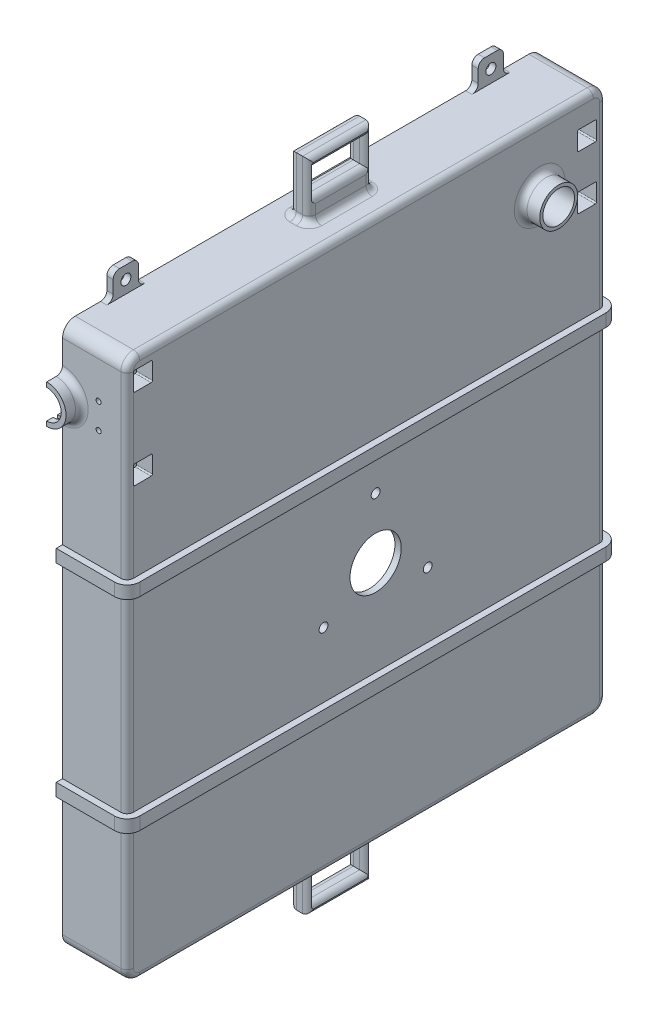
SolidWorks part; units mm, degrees
ref_plane "Front Plane" through (0, 0, 0) normal (0, 0, 1) x (1, 0, 0)
ref_plane "Top Plane" through (0, 0, 0) normal (0, 1, 0) x (1, 0, 0)
ref_plane "Right Plane" through (0, 0, 0) normal (1, 0, 0) x (0, 0, -1)
sketch "Sketch2" plane through (0, 0, 0) normal (1, 0, 0) x (0, 0, -1)
  line L0 (-382.5, 462.7139) -> (-382.5, -373.2861)
  line L1 (354, -373.2861) -> (-382.5, -373.2861)
  line L3 (-382.5, 462.7139) -> (354, 462.7139)
  line L4 (354, -373.2861) -> (354, 462.7139)
  line L9 (354, 350.7139) -> (354, 398.7139) construction
  line L11 (354, 374.7139) -> (-385.5, 374.7139) construction
  dimension "D1" = 88
  dimension "D2" = 736.5
  dimension "D3" = 3
  dimension "D4" = 836
extrude "Boss-Extrude1" add sketch "Sketch2" along normal blind 92
shell "Shell1" thickness 10
sketch "Sketch3" plane through (0, 0, 392.5) normal (0, 0, 1) x (1, 0, 0)
  circle A0 centre (0, 374.7139) radius 23
  dimension "D1" = 46
extrude "Cut-Extrude1" cut sketch "Sketch3" against normal blind 92
sketch "Sketch5" plane through (0, 0, 392.5) normal (0, 0, 1) x (1, 0, 0)
  line L0 (0, 405.2139) -> (0, 397.7139)
  line L3 (0, 351.7139) -> (0, 344.2139)
  arc A0 (0, 351.7139) -> (0, 397.7139) centre (0, 374.7139) ccw
  arc A1 (0, 344.2139) -> (0, 405.2139) centre (0, 374.7139) ccw
  dimension "D1" = 46
  dimension "D2" = 61
extrude "Boss-Extrude2" add sketch "Sketch5" along normal blind 25 contours A1 L0 A0 L3
sketch "Sketch6" plane through (0, 0, 0) normal (-1, 0, 0) x (0, 0, 1)
  line L0 (400.5, 351.7139) -> (407.5, 351.7139)
  line L1 (417.5, 351.7139) -> (382.5, 351.7139) construction
  line L2 (407.5, 351.7139) -> (407.5, 347.2139)
  line L3 (407.5, 347.2139) -> (400.5, 347.2139)
  line L4 (400.5, 347.2139) -> (400.5, 351.7139)
  line L5 (417.5, 351.7139) -> (417.5, 344.2139) construction
  line L6 (462.1748, 374.7139) -> (490.4215, 374.7139) construction
  line L7 (417.5, 374.7139) -> (392.5, 374.7139) construction
  dimension "D1" = 4.5
  dimension "D2" = 10
  dimension "D3" = 7
revolve "Cut-Revolve1" cut sketch "Sketch6" angle 360 about L6
fillet "Fillet1" radius 10 1 edges at (30.5, 374.7139, 392.5)
fillet "Fillet2" radius 20 7 edges at (46, -373.2861, 382.5) (46, -373.2861, -354) (51, -383.2861, 392.5) (51, -383.2861, -364) (46, 462.7139, -354) (51, 472.7139, -364) (51, 472.7139, 392.5)
sketch "Sketch10" plane through (0, 0, -354) normal (0, 0, 1) x (1, 0, 0)
  line L0 (0, 374.7139) -> (105.7299, 374.7139) construction
  circle A0 centre (45, 394.7139) radius 4
  circle A1 centre (45, 354.7139) radius 4
  dimension "D1" = 8
  dimension "D2" = 20
  dimension "D3" = 45
extrude "Cut-Extrude5" cut sketch "Sketch10" against normal blind 10
sketch "Sketch11" plane through (0, 472.7139, 0) normal (0, 1, 0) x (1, 0, 0)
  line L0 (0, 344) -> (0, -372.5) construction
  line L1 (0, 294) -> (10, 294)
  line L2 (0, 294) -> (0, 254)
  line L3 (0, 254) -> (10, 254)
  line L4 (10, 294) -> (10, 254)
  line L5 (102, 344) -> (0, 344) construction
  line L6 (0, -355.5) -> (0, -91.5) construction
  line L7 (0, -322.5) -> (10, -322.5)
  line L8 (0, -322.5) -> (0, -282.5)
  line L9 (0, -282.5) -> (10, -282.5)
  line L10 (10, -322.5) -> (10, -282.5)
  line L11 (0, -372.5) -> (102, -372.5) construction
  dimension "D1" = 10
  dimension "D2" = 40
  dimension "D3" = 50
  dimension "D4" = 40
  dimension "D5" = 10
  dimension "D6" = 50
extrude "Boss-Extrude4" add sketch "Sketch11" along normal blind 40
fillet "Fillet4" radius 10 8 edges at (5, 512.7139, -254) (5, 472.7139, -254) (5, 512.7139, -294) (5, 472.7139, -294) (5, 512.7139, 282.5) (5, 472.7139, 282.5) (5, 472.7139, 322.5) (5, 512.7139, 322.5)
sketch "Sketch12" plane through (0, 0, 0) normal (-1, 0, 0) x (0, 0, 1)
  line L0 (292.5, 512.7139) -> (312.5, 512.7139) construction
  line L1 (-254, 502.7139) -> (-254, 482.7139) construction
  line L2 (322.5, 502.7139) -> (322.5, 482.7139) construction
  line L3 (-284, 512.7139) -> (-264, 512.7139) construction
  circle A0 centre (302.5, 492.7139) radius 8
  circle A1 centre (-274, 492.7139) radius 8
  dimension "D1" = 16
  dimension "D2" = 16
  dimension "D3" = 20
  dimension "D4" = 20
  dimension "D5" = 20
  dimension "D6" = 20
extrude "Cut-Extrude6" cut sketch "Sketch12" against normal blind 40
sketch "Sketch13" plane through (0, 0, 0) normal (-1, 0, 0) x (0, 0, 1)
  line L0 (74.0966, 472.7139) -> (74.0966, -383.2861) construction
  line L1 (-244, 472.7139) -> (272.5, 472.7139) construction
  line L2 (372.5, -383.2861) -> (-344, -383.2861) construction
  line L3 (74.0966, 44.7139) -> (483.6536, 44.7139) construction
ref_plane "Plane1" through (0, 44.7139, 0) normal (0, 1, 0) x (1, 0, 0)
mirror "Mirror1" about plane through (0, 44.7139, 0) normal (0, 1, 0) of "Boss-Extrude4", "Fillet4", "Cut-Extrude6"
fillet "Fillet5" radius 10 4 edges at (5, -383.2861, 282.5) (5, -383.2861, 322.5) (5, -383.2861, -254) (5, -383.2861, -294)
sketch "Sketch14" plane through (0, 0, 0) normal (-1, 0, 0) x (0, 0, 1)
  line L0 (-334, 462.7139) -> (382.5, 462.7139) construction
  line L1 (-304, 462.7139) -> (-244, 462.7139)
  line L2 (332.5, 462.7139) -> (272.5, 462.7139)
  line L3 (74.0966, 44.7139) -> (483.6536, 44.7139) construction
  line L4 (332.5, -373.2861) -> (272.5, -373.2861)
  line L5 (-304, -373.2861) -> (-244, -373.2861)
  line L6 (362.5, -373.2861) -> (-334, -373.2861) construction
  line L7 (-354, -353.2861) -> (-354, 442.7139) construction
  line L8 (332.5, -373.2861) -> (272.5, -373.2861)
  line L9 (-354, -353.2861) -> (-354, -348.2861)
  line L10 (-329, -373.2861) -> (-334, -373.2861)
  line L11 (-244, -373.2861) -> (-304, -373.2861)
  line L12 (-329, 462.7139) -> (-334, 462.7139)
  line L13 (-354, 442.7139) -> (-354, 437.7139)
  line L14 (-364, 44.7139) -> (392.5, 44.7139) construction
  line L15 (-364, -363.2861) -> (-364, 452.7139) construction
  line L16 (392.5, 334.2139) -> (392.5, -363.2861) construction
  line L17 (14.25, 44.7139) -> (14.25, 144.8214) construction
  line L18 (357.5, -373.2861) -> (362.5, -373.2861)
  line L19 (382.5, -353.2861) -> (382.5, -348.2861)
  line L20 (382.5, 442.7139) -> (382.5, 437.7139)
  line L21 (357.5, 462.7139) -> (362.5, 462.7139)
  arc A0 (-304, 462.7139) -> (-244, 462.7139) centre (-274, 462.7139) ccw
  arc A1 (272.5, 462.7139) -> (332.5, 462.7139) centre (302.5, 462.7139) ccw
  arc A2 (392.5, 452.7139) -> (372.5, 472.7139) centre (372.5, 452.7139) ccw construction
  arc A3 (-304, -373.2861) -> (-244, -373.2861) centre (-274, -373.2861) cw
  arc A4 (272.5, -373.2861) -> (332.5, -373.2861) centre (302.5, -373.2861) cw
  arc A5 (-329, -373.2861) -> (-354, -348.2861) centre (-354, -373.2861) ccw
  arc A6 (-354, -353.2861) -> (-334, -373.2861) centre (-334, -353.2861) ccw construction
  arc A7 (-354, -353.2861) -> (-334, -373.2861) centre (-334, -353.2861) ccw
  arc A8 (-354, 442.7139) -> (-334, 462.7139) centre (-334, 442.7139) cw
  arc A9 (-329, 462.7139) -> (-354, 437.7139) centre (-354, 462.7139) cw
  arc A10 (382.5, -353.2861) -> (362.5, -373.2861) centre (362.5, -353.2861) cw
  arc A11 (357.5, -373.2861) -> (382.5, -348.2861) centre (382.5, -373.2861) cw
  dimension "D1" = 60
  dimension "D3" = 60
  dimension "D4" = 70
  dimension "D5" = 50
  dimension "D2" = 70
extrude "Boss-Extrude5" add sketch "Sketch14" against normal through all
fillet "Fillet6" radius 10 15 edges at (92, 445.0363, -336.3223) (92, 462.7139, -316.5) (92, 432.7139, -274) (92, 462.7139, 14.25) (92, 432.7139, 302.5) (92, 462.7139, 357.5) (92, 57.2139, 382.5) (92, -355.6084, 364.8223) (92, -373.2861, 345) (92, -343.2861, 302.5) (92, -373.2861, 14.25) (92, -343.2861, -274) (92, -373.2861, -316.5) (92, -355.6084, -336.3223) (92, 44.7139, -354)
fillet "Fillet7" radius 10 8 edges at (102, 466.8561, 386.6421) (102, 472.7139, 14.25) (102, 466.8561, -358.1421) (102, 44.7139, -364) (102, -377.4282, -358.1421) (102, -383.2861, 14.25) (102, -377.4282, 386.6421) (102, 44.7139, 392.5)
sketch "Sketch15" plane through (102, 0, 0) normal (1, 0, 0) x (0, 0, -1)
  circle A0 centre (0, 0) radius 40.5
  dimension "D1" = 81
extrude "Cut-Extrude7" cut sketch "Sketch15" against normal blind 40
sketch "Sketch16" plane through (102, 0, 0) normal (1, 0, 0) x (0, 0, -1)
  circle A0 centre (0, 0) radius 28
  circle A1 centre (0, 0) radius 33
  dimension "D1" = 56
  dimension "D2" = 66
ref_plane "Plane2" through (0, 150, 0) normal (0, 1, 0) x (1, 0, 0)
sketch "Sketch19" plane through (0, 150, 0) normal (0, 1, 0) x (1, 0, 0)
  line L0 (0, -402.5) -> (92, -402.5)
  line L1 (0, 364) -> (92, 364)
  line L3 (0, -392.5) -> (92, -392.5)
  line L4 (102, 354) -> (102, -382.5)
  line L5 (112, 354) -> (112, -382.5)
  line L6 (0, 374) -> (92, 374)
  line L7 (0, -402.5) -> (0, -392.5)
  line L8 (0, 374) -> (0, 364)
  arc A0 (92, 364) -> (102, 354) centre (92, 354) cw
  arc A1 (92, -392.5) -> (102, -382.5) centre (92, -382.5) ccw
  arc A2 (92, -402.5) -> (112, -382.5) centre (92, -382.5) ccw
  arc A3 (92, 374) -> (112, 354) centre (92, 354) cw
  point P7 (102, 364)
  point P10 (102, -392.5)
  dimension "D3" = 10
  dimension "D1" = 92
  dimension "D2" = 756.5
  dimension "D4" = 10
extrude "Boss-Extrude7" add sketch "Sketch19" along normal blind 20
sketch "Sketch21" plane through (0, 0, -354) normal (0, 0, 1) x (1, 0, 0)
  line L0 (0, 472.7139) -> (0, -383.2861) construction
  line L1 (10, 430.7139) -> (0, 430.7139)
  line L2 (10, 430.7139) -> (10, 410.7139)
  line L3 (10, 410.7139) -> (0, 410.7139)
  line L4 (0, 430.7139) -> (0, 410.7139)
  dimension "D1" = 20
sketch "Sketch25" plane through (92, 0, 0) normal (-1, 0, 0) x (0, 0, 1)
  line L0 (-316, 462.7139) -> (-316, 332.7139)
  line L1 (-354, -348.2861) -> (-354, 437.7139) construction
  line L2 (-316, 462.7139) -> (-354, 462.7139)
  line L3 (-354, 462.7139) -> (-354, 282.7139)
  line L4 (-329, 462.7139) -> (-304, 462.7139) construction
  arc A0 (-316, 332.7139) -> (-354, 282.7139) centre (-367.8947, 332.7139) cw
  dimension "D1" = 130
  dimension "D2" = 50
  dimension "D3" = 38
extrude "Boss-Extrude8" add sketch "Sketch25" along normal blind 32
fillet "Fillet10" radius 2 11 edges at (60, 360.2139, -354) (60, 462.7139, -322.5) (71, 282.7139, -354) (87.4318, 283.1876, -352.3962) (71, 462.7139, -316) (89.0711, 459.785, -316) (92, 392.7139, -316) (60, 397.7139, -316) (92, 305.7598, -323.5491) (60, 301.3133, -326.5781) (60, 445.0363, -336.3223)
sketch "Sketch26" plane through (60, 0, 0) normal (-1, 0, 0) x (0, 0, 1)
  circle A0 centre (-334, 417.2139) radius 7
  circle A1 centre (-334, 332.2139) radius 7
  dimension "D1" = 14
  dimension "D2" = 14
extrude "Cut-Extrude10" cut sketch "Sketch26" against normal through all
sketch "Sketch27" plane through (102, 0, 0) normal (1, 0, 0) x (0, 0, -1)
  line L1 (321, 402.2139) -> (347, 402.2139)
  line L2 (319, 404.2139) -> (319, 430.2139)
  line L3 (321, 432.2139) -> (347, 432.2139)
  line L4 (349, 404.2139) -> (349, 430.2139)
  line L5 (319, 402.2139) -> (349, 432.2139) construction
  line L6 (319, 432.2139) -> (349, 402.2139) construction
  line L7 (321, 317.2139) -> (347, 317.2139)
  line L8 (319, 319.2139) -> (319, 345.2139)
  line L9 (321, 347.2139) -> (347, 347.2139)
  line L10 (349, 319.2139) -> (349, 345.2139)
  line L11 (319, 317.2139) -> (349, 347.2139) construction
  line L12 (319, 347.2139) -> (349, 317.2139) construction
  arc A0 (347, 317.2139) -> (349, 319.2139) centre (347, 319.2139) ccw
  arc A1 (321, 317.2139) -> (319, 319.2139) centre (321, 319.2139) cw
  arc A2 (347, 347.2139) -> (349, 345.2139) centre (347, 345.2139) cw
  arc A3 (319, 345.2139) -> (321, 347.2139) centre (321, 345.2139) cw
  arc A4 (347, 432.2139) -> (349, 430.2139) centre (347, 430.2139) cw
  arc A5 (347, 402.2139) -> (349, 404.2139) centre (347, 404.2139) ccw
  arc A6 (321, 402.2139) -> (319, 404.2139) centre (321, 404.2139) cw
  arc A7 (319, 430.2139) -> (321, 432.2139) centre (321, 430.2139) cw
  point P0 (334, 417.2139)
  point P6 (334, 332.2139)
  dimension "D2" = 2
  dimension "D1" = 30
extrude "Cut-Extrude11" cut sketch "Sketch27" against normal blind 35
sketch "Sketch28" plane through (92, 0, 0) normal (-1, 0, 0) x (0, 0, 1)
  line L0 (344.5, 462.7139) -> (344.5, 312.7139)
  line L1 (332.5, 462.7139) -> (382.5, 462.7139) construction
  line L3 (382.5, 351.7139) -> (382.5, -348.2861) construction
  line L4 (344.5, 462.7139) -> (382.5, 462.7139)
  line L5 (382.5, 462.7139) -> (382.5, 266.7139)
  arc A0 (382.5, 266.7139) -> (344.5, 312.7139) centre (391.3421, 312.7139) cw
  dimension "D1" = 38
  dimension "D2" = 150
  dimension "D3" = 46
extrude "Boss-Extrude10" add sketch "Sketch28" along normal blind 30
fillet "Fillet11" radius 2 10 edges at (89.0711, 459.785, 344.5) (62, 364.7139, 382.5) (72, 462.7139, 344.5) (62, 282.8811, 355.2286) (92, 382.7139, 344.5) (72, 266.7139, 382.5) (89.6848, 267.5548, 378.8988) (62, 462.7139, 363.5) (62, 387.7139, 344.5) (92, 287.1056, 352.1197)
sketch "Sketch29" plane through (102, 0, 0) normal (1, 0, 0) x (0, 0, -1)
  circle A0 centre (-367.5, 438.7139) radius 7
  circle A1 centre (-367.5, 310.7139) radius 7
  dimension "D1" = 14
  dimension "D2" = 14
extrude "Cut-Extrude12" cut sketch "Sketch29" against normal through all
sketch "Sketch30" plane through (102, 0, 0) normal (1, 0, 0) x (0, 0, -1)
  line L1 (-380.5, 423.7139) -> (-354.5, 423.7139)
  line L2 (-382.5, 425.7139) -> (-382.5, 451.7139)
  line L3 (-380.5, 453.7139) -> (-354.5, 453.7139)
  line L4 (-352.5, 425.7139) -> (-352.5, 451.7139)
  line L5 (-382.5, 423.7139) -> (-352.5, 453.7139) construction
  line L6 (-382.5, 453.7139) -> (-352.5, 423.7139) construction
  line L7 (-380.5, 325.7139) -> (-354.5, 325.7139)
  line L8 (-382.5, 323.7139) -> (-382.5, 297.7139)
  line L9 (-380.5, 295.7139) -> (-354.5, 295.7139)
  line L10 (-352.5, 323.7139) -> (-352.5, 297.7139)
  line L11 (-382.5, 325.7139) -> (-352.5, 295.7139) construction
  line L12 (-382.5, 295.7139) -> (-352.5, 325.7139) construction
  arc A0 (-380.5, 325.7139) -> (-382.5, 323.7139) centre (-380.5, 323.7139) ccw
  arc A1 (-382.5, 297.7139) -> (-380.5, 295.7139) centre (-380.5, 297.7139) ccw
  arc A2 (-354.5, 295.7139) -> (-352.5, 297.7139) centre (-354.5, 297.7139) ccw
  arc A3 (-352.5, 323.7139) -> (-354.5, 325.7139) centre (-354.5, 323.7139) ccw
  arc A4 (-354.5, 453.7139) -> (-352.5, 451.7139) centre (-354.5, 451.7139) cw
  arc A5 (-354.5, 423.7139) -> (-352.5, 425.7139) centre (-354.5, 425.7139) ccw
  arc A6 (-382.5, 425.7139) -> (-380.5, 423.7139) centre (-380.5, 425.7139) ccw
  arc A7 (-382.5, 451.7139) -> (-380.5, 453.7139) centre (-380.5, 451.7139) cw
  point P0 (-367.5, 438.7139)
  point P6 (-367.5, 310.7139)
  dimension "D2" = 2
  dimension "D1" = 30
extrude "Cut-Extrude13" cut sketch "Sketch30" against normal blind 25
sketch "Sketch31" plane through (0, 0, 392.5) normal (0, 0, 1) x (1, 0, 0)
  circle A0 centre (57, 394.7139) radius 4
  circle A1 centre (57, 354.7139) radius 4
  dimension "D1" = 8
  dimension "D2" = 8
extrude "Cut-Extrude14" cut sketch "Sketch31" against normal blind 26
sketch "Sketch32" plane through (102, 0, 0) normal (1, 0, 0) x (0, 0, -1)
  circle A0 centre (0, 95) radius 7
  circle A1 centre (-82.2724, -47.5) radius 7
  circle A2 centre (82.2724, -47.5) radius 7
  dimension "D1" = 14
  dimension "D2" = 14
  dimension "D3" = 14
extrude "Cut-Extrude15" cut sketch "Sketch32" against normal through all
mirror "Mirror2" about plane through (0, 0, 0) normal (0, 1, 0) of "Boss-Extrude7"
sketch "Sketch33" plane through (0, 472.7139, 0) normal (0, 1, 0) x (1, 0, 0)
  line L0 (46, -372.5) -> (46, 344) construction
  line L1 (31, -64.25) -> (61, -64.25)
  line L2 (31, -64.25) -> (31, 35.75)
  line L3 (31, 35.75) -> (61, 35.75)
  line L4 (61, -64.25) -> (61, 35.75)
  line L5 (31, -64.25) -> (61, 35.75) construction
  line L6 (31, 35.75) -> (61, -64.25) construction
  line L7 (0, -372.5) -> (92, -372.5) construction
  line L8 (92, 344) -> (0, 344) construction
  point P2 (46, -14.25)
  dimension "D1" = 100
  dimension "D2" = 30
extrude "Boss-Extrude11" add sketch "Sketch33" along normal blind 90
sketch "Sketch34" plane through (61, 0, 0) normal (1, 0, 0) x (0, 0, -1)
  line L0 (-64.25, 562.7139) -> (35.75, 562.7139) construction
  line L1 (-54.25, 507.7139) -> (25.75, 507.7139)
  line L2 (-54.25, 507.7139) -> (-54.25, 547.7139)
  line L3 (-54.25, 547.7139) -> (25.75, 547.7139)
  line L4 (25.75, 507.7139) -> (25.75, 547.7139)
  line L5 (-54.25, 507.7139) -> (25.75, 547.7139) construction
  line L6 (-54.25, 547.7139) -> (25.75, 507.7139) construction
  line L8 (-64.25, 562.7139) -> (-64.25, 472.7139) construction
  point P0 (-14.25, 527.7139)
  dimension "D1" = 80
  dimension "D2" = 40
  dimension "D3" = 15
  dimension "D4" = 10
extrude "Cut-Extrude16" cut sketch "Sketch34" against normal blind 90
fillet "Fillet12" radius 10 18 edges at (31, 472.7139, 14.25) (46, 472.7139, 64.25) (61, 472.7139, 14.25) (46, 472.7139, -35.75) (31, 517.7139, -35.75) (31, 562.7139, 14.25) (31, 517.7139, 64.25) (31, 527.7139, 54.25) (31, 547.7139, 14.25) (31, 527.7139, -25.75) (31, 507.7139, 14.25) (61, 517.7139, 64.25) (61, 562.7139, 14.25) (61, 517.7139, -35.75) (61, 527.7139, 54.25) (61, 507.7139, 14.25) (61, 527.7139, -25.75) (61, 547.7139, 14.25)
mirror "Mirror3" about plane through (0, 44.7139, 0) normal (0, 1, 0) of "Boss-Extrude11", "Cut-Extrude16", "Fillet12"
sketch "Sketch37" plane through (102, 0, 0) normal (1, 0, 0) x (0, 0, -1)
  circle A0 centre (259.1905, 372.3588) radius 25
  circle A1 centre (259.1905, 372.3588) radius 30
  dimension "D1" = 50
  dimension "D2" = 60
extrude "Boss-Extrude12" add sketch "Sketch37" along normal blind 30
sketch "Sketch39" plane through (102, 0, 0) normal (1, 0, 0) x (0, 0, -1)
  circle A1 centre (259.1905, 372.3588) radius 25
  circle A2 centre (259.1905, 372.3588) radius 25
  dimension "D1" = 0
extrude "Cut-Extrude17" cut sketch "Sketch39" against normal blind 72
fillet "Fillet13" radius 10 1 edges at (102, 372.3588, -289.1905)
